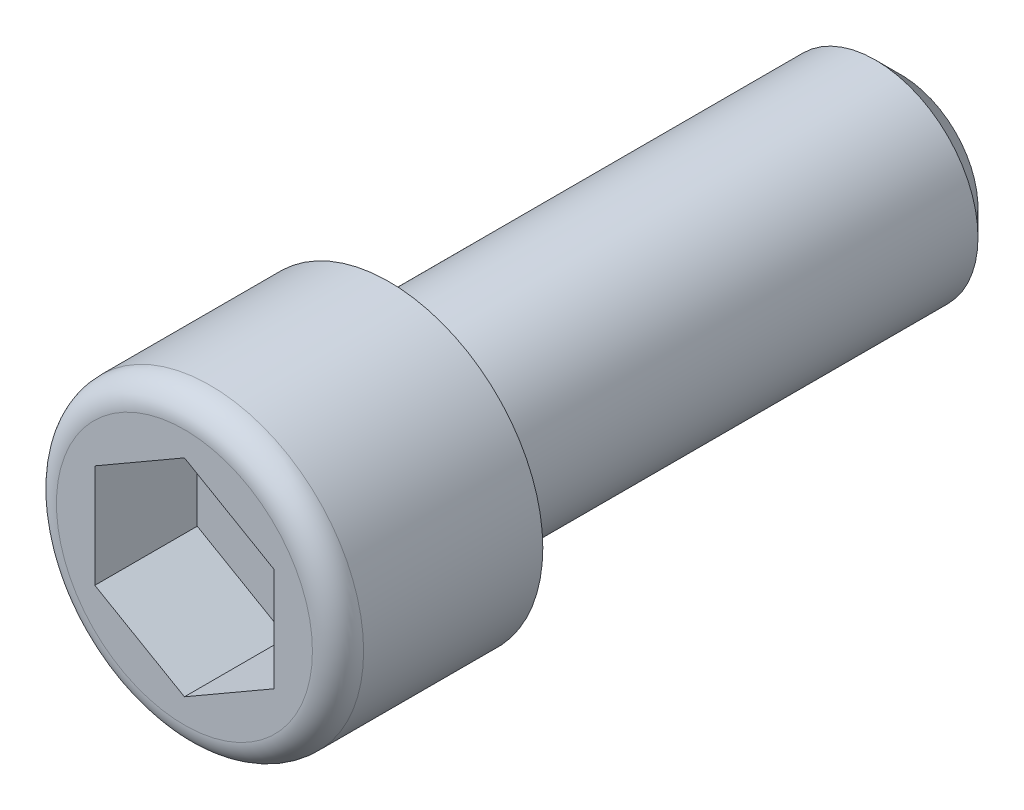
SolidWorks part; units mm, degrees
ref_plane "Face" through (0, 0, 0) normal (0, 0, 1) x (1, 0, 0)
ref_plane "Dessus" through (0, 0, 0) normal (0, 1, 0) x (1, 0, 0)
ref_plane "Droite" through (0, 0, 0) normal (1, 0, 0) x (0, 0, -1)
sketch "Esquisse1" plane through (0, 0, 0) normal (0, 0, 1) x (1, 0, 0)
  circle A0 centre (0, 0) radius 6
  dimension "D1" = 12
extrude "Base-Extrusion" add sketch "Esquisse1" against normal blind 8
sketch "Esquisse2" plane through (0, 0, -8) normal (0, 0, -1) x (-1, 0, 0)
  circle A0 centre (0, 0) radius 4
  dimension "D1" = 8
extrude "Boss.-Extru.1" add sketch "Esquisse2" along normal blind 20
chamfer "Chanfrein1" distance 1 angle 45 1 edges at (-4, 0, -28)
sketch "Esquisse3" plane through (0, 0, 0) normal (0, 0, 1) x (1, 0, 0)
  line L1 (-3.5, -2.0207) -> (0, -4.0415)
  line L2 (0, -4.0415) -> (3.5, -2.0207)
  line L3 (3.5, -2.0207) -> (3.5, 2.0207)
  line L4 (3.5, 2.0207) -> (0, 4.0415)
  line L5 (0, 4.0415) -> (-3.5, 2.0207)
  line L6 (-3.5, 2.0207) -> (-3.5, -2.0207)
  circle A0 centre (0, 0) radius 3.5 construction
  dimension "D1" = 7
extrude "Enlèv. mat.-Extru.1" cut sketch "Esquisse3" against normal blind 4
fillet "Congé1" radius 1 1 edges at (6, 0, 0)
